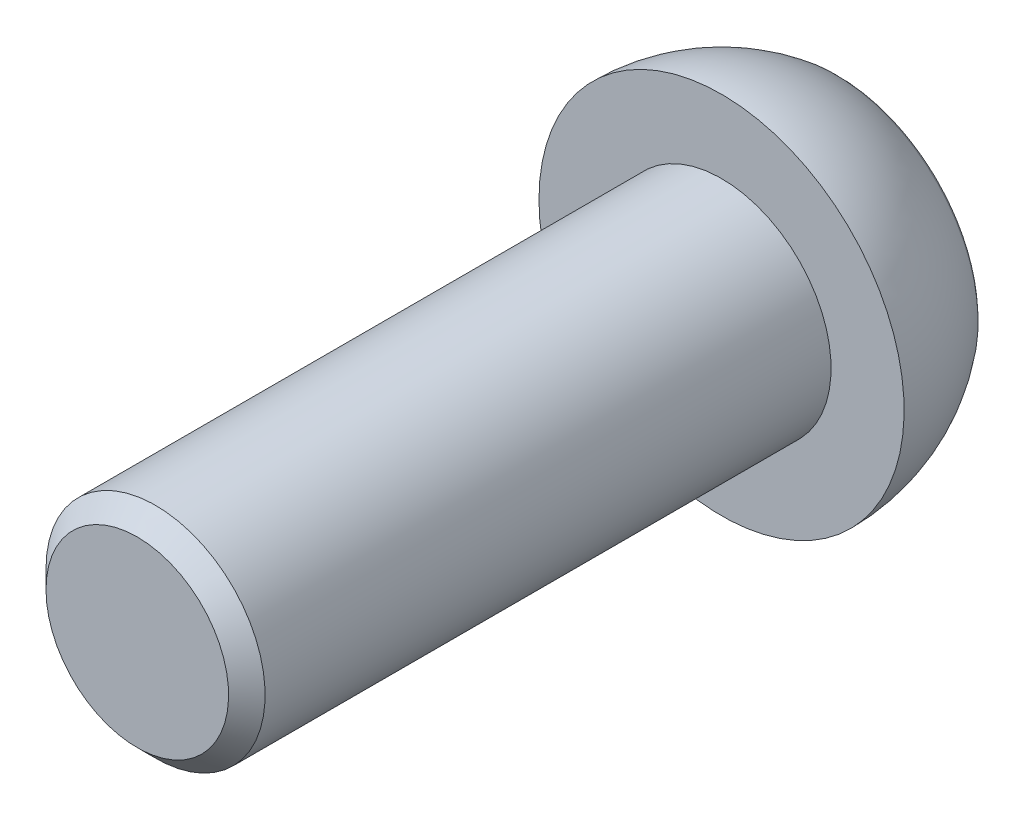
SolidWorks part; units mm, degrees
ref_plane "Face" through (0, 0, 0) normal (0, 0, 1) x (1, 0, 0)
ref_plane "Dessus" through (0, 0, 0) normal (0, 1, 0) x (1, 0, 0)
ref_plane "Droite" through (0, 0, 0) normal (1, 0, 0) x (0, 0, -1)
imported_body "Importée1"
sketch "Esquisse1" plane through (0, 0, -7) normal (0, 0, 1) x (1, 0, 0)
  circle A0 centre (-59.1026, 256.2254) radius 3 construction
  circle A1 centre (-59.1026, 256.2254) radius 3
extrude "Extrusion1" add sketch "Esquisse1" against normal up to surface (16 mm away)
chamfer "Chanfrein1" distance 0.5 angle 45
